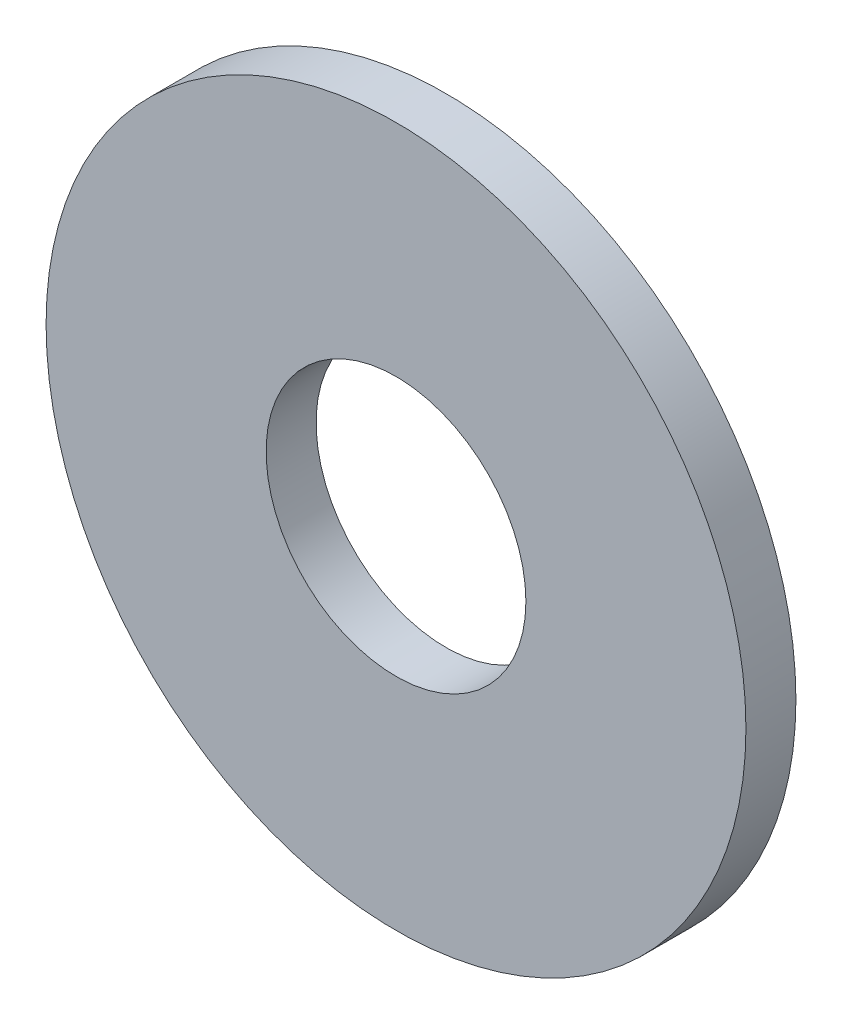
SolidWorks part; units mm, degrees
ref_plane "Front Plane" through (0, 0, 0) normal (0, 0, 1) x (1, 0, 0)
ref_plane "Top Plane" through (0, 0, 0) normal (0, 1, 0) x (1, 0, 0)
ref_plane "Right Plane" through (0, 0, 0) normal (1, 0, 0) x (0, 0, -1)
sketch "Sketch1" plane through (0, 0, 0) normal (0, 0, 1) x (1, 0, 0)
  circle A0 centre (195.8383, 4.2076) radius 8.89
  circle A1 centre (195.8383, 4.2076) radius 3.3 construction
  circle A2 centre (195.8383, 4.2076) radius 3.3
  dimension "D1" = 17.78
extrude "Boss-Extrude1" add sketch "Sketch1" along normal blind 1.27
